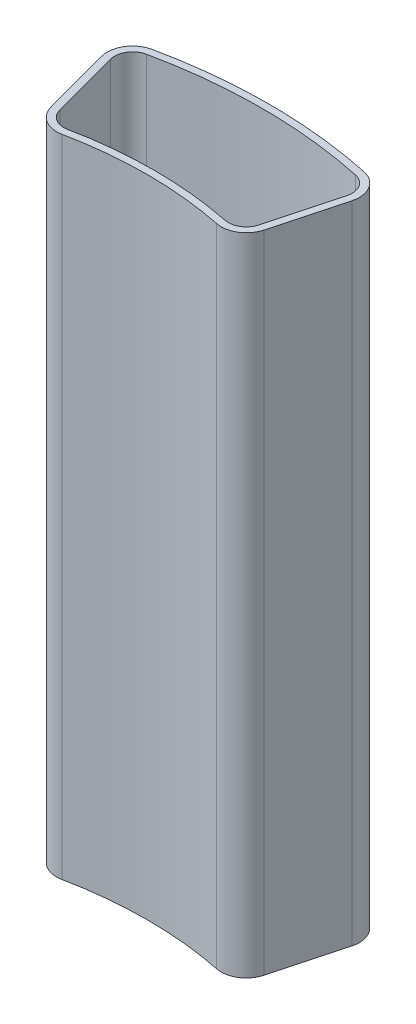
SolidWorks part; units mm, degrees
ref_plane "Front" through (0, 0, 0) normal (0, 0, 1) x (1, 0, 0)
ref_plane "Top" through (0, 0, 0) normal (0, 1, 0) x (1, 0, 0)
ref_plane "Right" through (0, 0, 0) normal (1, 0, 0) x (0, 0, -1)
sketch "Sketch1" plane through (0, 0, 0) normal (0, 1, 0) x (1, 0, 0)
  line L0 (0, 0) -> (-27.9525, 104.32) construction
  line L1 (-27.9525, 104.32) -> (-36.7523, 137.1615)
  line L2 (0, 0) -> (27.9525, 104.32) construction
  line L3 (27.9525, 104.32) -> (36.7523, 137.1615)
  line L4 (0, 0) -> (0, 108) construction
  arc A0 (36.7523, 137.1615) -> (-36.7523, 137.1615) centre (0, 0) ccw
  arc A1 (27.9525, 104.32) -> (-27.9525, 104.32) centre (0, 0) ccw
  dimension "D1" = 284
  dimension "D2" = 216
  dimension "D3" = 30
extrude "Boss-Extrude1" add sketch "Sketch1" along normal blind 180
fillet "Fillet1" radius 7 4 edges at (-36.7523, 90, -137.1615) (-27.9525, 90, -104.32) (36.7523, 90, -137.1615) (27.9525, 90, -104.32)
shell "Shell1" thickness 2
